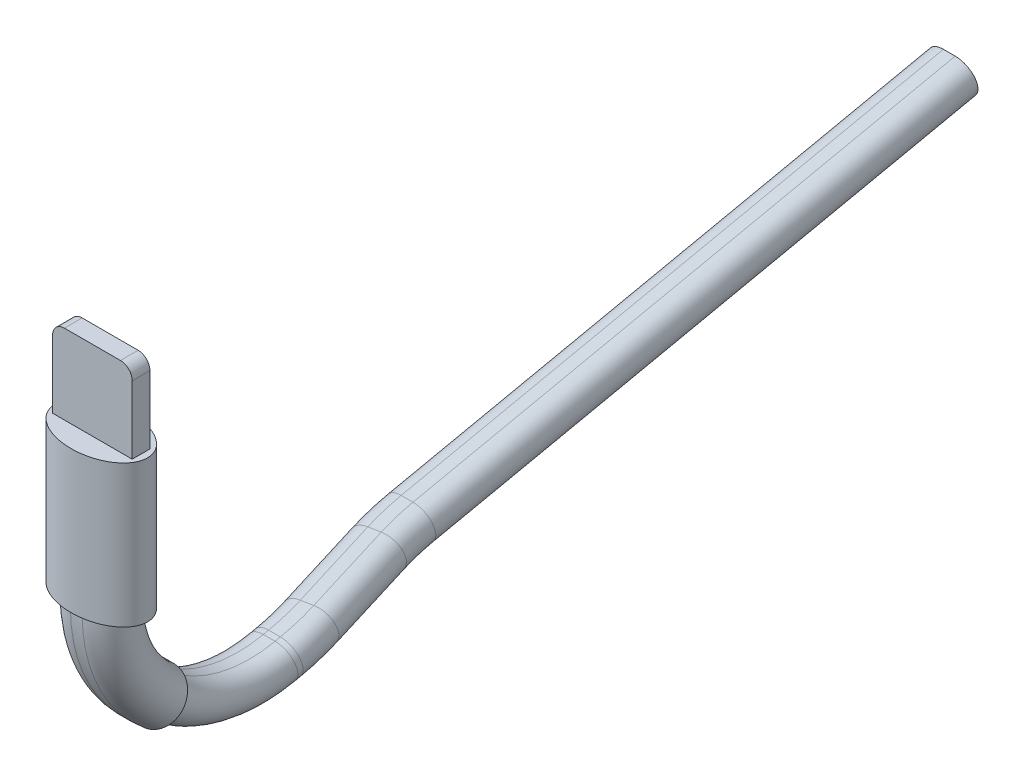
SolidWorks part; units mm, degrees
ref_plane "Front Plane" through (0, 0, 0) normal (0, 0, 1) x (1, 0, 0)
ref_plane "Top Plane" through (0, 0, 0) normal (0, 1, 0) x (1, 0, 0)
ref_plane "Right Plane" through (0, 0, 0) normal (1, 0, 0) x (0, 0, -1)
sketch "Sketch1" plane through (0, 0, 0) normal (0, 1, 0) x (1, 0, 0)
  ellipse E0 centre (0, 0) end of major axis (3.925, 0) minor radius 2.5625
  dimension "D1" = 5.125
  dimension "D2" = 7.85
extrude "Boss-Extrude1" add sketch "Sketch1" along normal blind 12.05
sketch "Sketch3" plane through (0, 12.05, 0) normal (0, 1, 0) x (1, 0, 0)
  line L1 (-3.375, 0.75) -> (3.375, 0.75)
  line L2 (-3.375, 0.75) -> (-3.375, -0.75)
  line L3 (-3.375, -0.75) -> (3.375, -0.75)
  line L4 (3.375, 0.75) -> (3.375, -0.75)
  line L5 (-3.375, 0.75) -> (3.375, -0.75) construction
  line L6 (-3.375, -0.75) -> (3.375, 0.75) construction
  point P0 (0, 0)
  dimension "D1" = 1.5
  dimension "D2" = 6.75
extrude "Boss-Extrude3" add sketch "Sketch3" along normal blind 6.75
fillet "Fillet1" radius 1 2 edges at (-3.375, 18.8, 0) (3.375, 18.8, 0)
sketch "Sketch2" plane through (0, 0, 0) normal (0, 1, 0) x (1, 0, 0)
  line L0 (-0.5, 0) -> (0.5, 0) construction
  line L1 (-0.5, 1.575) -> (0.5, 1.575)
  line L2 (-0.5, -1.575) -> (0.5, -1.575)
  arc A0 (-0.5, 1.575) -> (-0.5, -1.575) centre (-0.5, 0) ccw
  arc A1 (0.5, -1.575) -> (0.5, 1.575) centre (0.5, 0) ccw
  point P3 (0, 0)
  dimension "D1" = 1.575
  dimension "D2" = 1
sketch "Sketch4" plane through (0, 0, 0) normal (1, 0, 0) x (0, 0, -1)
  line L0 (0, 0) -> (0, -14.8884) construction
  line L1 (0, -14.8884) -> (14.563, -11.7929) construction
  line L3 (-12.7796, -20.6718) -> (94.9474, 2.2263) construction
  arc A0 (0, 0) -> (14.563, -11.7929) centre (12.0564, 0) ccw
  dimension "D1" = 3
  dimension "D3" = 78
sweep "Sweep1" add profiles "Sketch2" path "Sketch4"
sketch "Sketch5" plane through (0, 0, 0) normal (1, 0, 0) x (0, 0, -1)
  arc A1 (0, 0) -> (4.2905, -9.2221) centre (12.0564, 0) ccw
  arc A2 (0, 0) -> (14.563, -11.7929) centre (12.0564, 0) ccw construction
  dimension "D1" = 10.5
sketch "Sketch6" plane through (0, 0, 0) normal (0, -1, 0) x (1, 0, 0)
  line L0 (-0.5, 0) -> (0.5, 0) construction
  line L1 (-0.5, 2.125) -> (0.5, 2.125)
  line L2 (-0.5, -2.125) -> (0.5, -2.125)
  arc A0 (-0.5, 2.125) -> (-0.5, -2.125) centre (-0.5, 0) ccw
  arc A1 (0.5, -2.125) -> (0.5, 2.125) centre (0.5, 0) ccw
  point P3 (0, 0)
  dimension "D1" = 2.125
  dimension "D2" = 1
sweep "Sweep2" add profiles "Sketch6" path "Sketch5"
ref_plane "Plane1" through (0, -14.2448, -3.0278) normal (0, -0.9781, -0.2079) x (-1, 0, 0)
sketch "Sketch8" plane through (0, -14.2448, -3.0278) normal (0, -0.9781, -0.2079) x (-1, 0, 0)
  line L0 (0, 11.7929) -> (0, 12.2521)
  line L1 (0.236, 15.3155) -> (1.314, 22.2703)
  line L2 (1.55, 25.3337) -> (1.55, 72.337)
  line L3 (7.8603, 72.337) -> (-7.8603, 72.337) construction
  arc A0 (0, 12.2521) -> (0.236, 15.3155) centre (20, 12.2521) cw
  arc A1 (1.314, 22.2703) -> (1.55, 25.3337) centre (-18.45, 25.3337) ccw
  point P10 (0, 13.7929)
  point P13 (1.55, 23.7929)
  dimension "D4" = 20
  dimension "D1" = 1.55
  dimension "D2" = 2
  dimension "D3" = 10
curve "CompCurve1"
sketch "Sketch9" plane through (0, 2.4519, -11.5352) normal (0, 0.2079, -0.9781) x (-1, 0, 0)
  line L2 (0.5, -12.988) -> (-0.5, -12.988)
  line L3 (-0.5, -16.138) -> (0.5, -16.138)
  line L4 (0.5, -12.988) -> (-0.5, -12.988)
  line L5 (-0.5, -16.138) -> (0.5, -16.138)
  arc A3 (0.5, -16.138) -> (0.5, -12.988) centre (0.5, -14.563) ccw
  arc A4 (-0.5, -12.988) -> (-0.5, -16.138) centre (-0.5, -14.563) ccw
  arc A5 (0.5, -16.138) -> (0.5, -12.988) centre (0.5, -14.563) ccw
  arc A6 (-0.5, -12.988) -> (-0.5, -16.138) centre (-0.5, -14.563) ccw
  dimension "D1" = 0
sweep "Sweep3" add profiles "Sketch9" path "CompCurve1"
